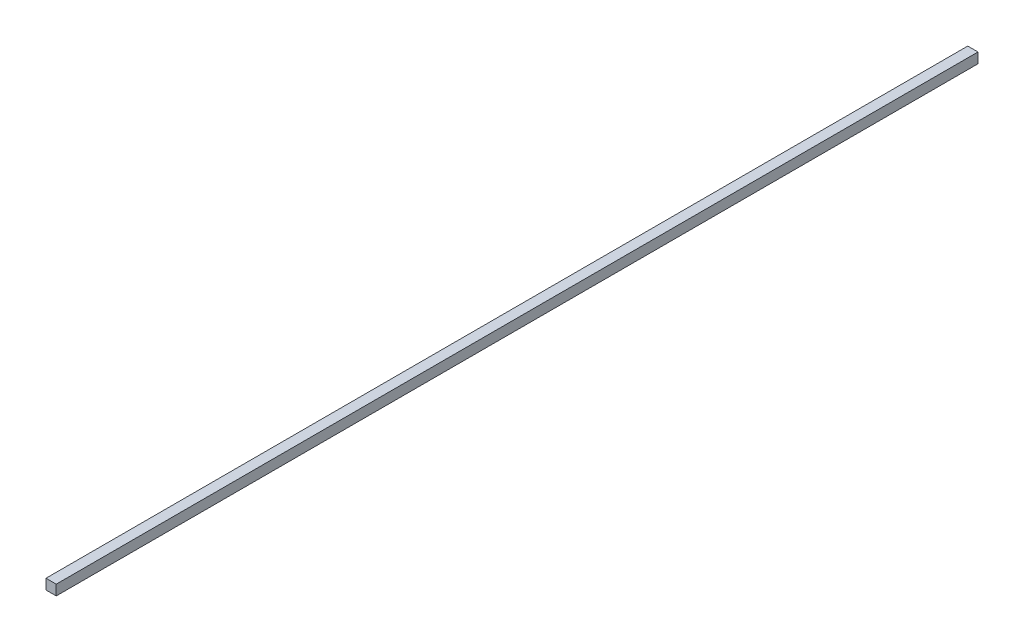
SolidWorks part; units mm, degrees
ref_plane "Plan de face" through (0, 0, 0) normal (0, 0, 1) x (1, 0, 0)
ref_plane "Plan de dessus" through (0, 0, 0) normal (0, 1, 0) x (1, 0, 0)
ref_plane "Plan de droite" through (0, 0, 0) normal (1, 0, 0) x (0, 0, -1)
sketch "Esquisse1" plane through (0, 0, 0) normal (0, 0, 1) x (1, 0, 0)
  line L1 (-1, 1) -> (1, 1)
  line L2 (-1, 1) -> (-1, -1)
  line L3 (-1, -1) -> (1, -1)
  line L4 (1, 1) -> (1, -1)
  point P4 (0, 1)
  point P5 (-1, 0)
  dimension "D1" = 2
  dimension "D2" = 2
extrude "Extrusion1" add sketch "Esquisse1" along normal mid plane 180
